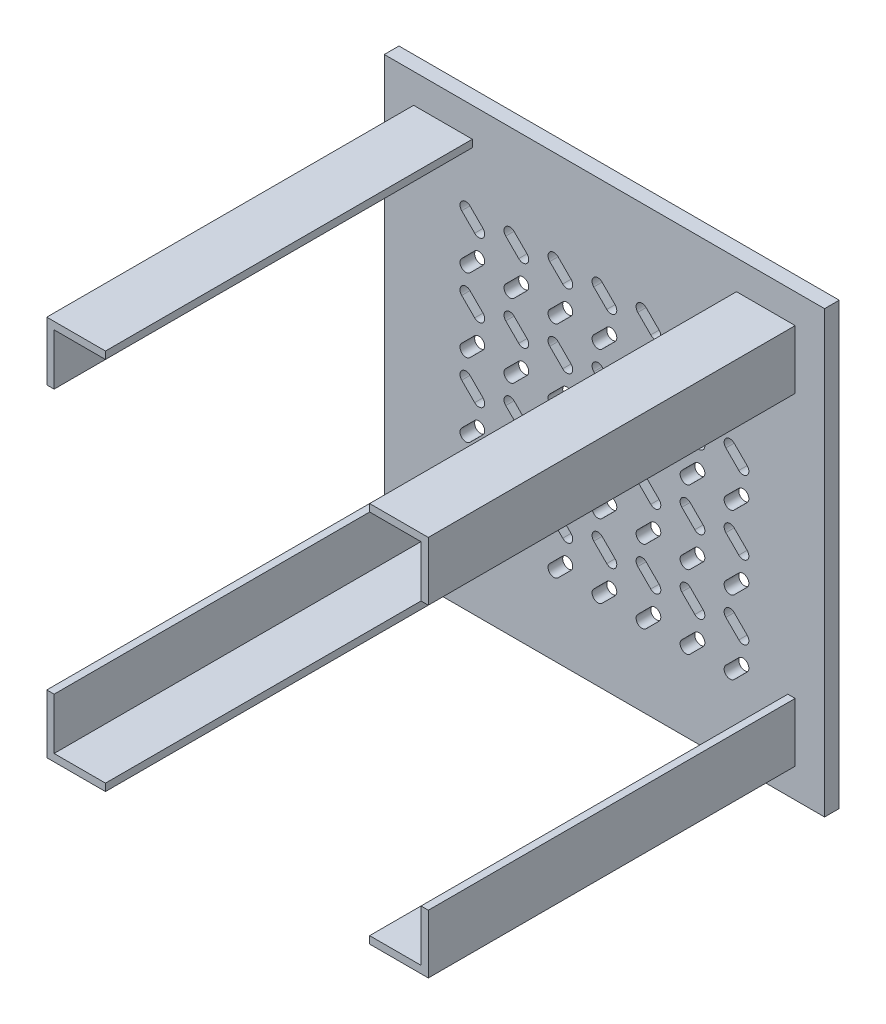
SolidWorks part; units mm, degrees
ref_plane "Front Plane" through (0, 0, 0) normal (0, 0, 1) x (1, 0, 0)
ref_plane "Top Plane" through (0, 0, 0) normal (0, 1, 0) x (1, 0, 0)
ref_plane "Right Plane" through (0, 0, 0) normal (1, 0, 0) x (0, 0, -1)
sketch "Sketch2" plane through (0, 0, 0) normal (0, 1, 0) x (1, 0, 0)
  line L0 (-150, 10) -> (150, 10)
  line L1 (150, 10) -> (150, 0)
  line L4 (150, 0) -> (-150, 0)
  line L7 (-150, 0) -> (-150, 10)
  line L8 (0, 0) -> (0, 128.5458) construction
  point P2 (0, 0)
  point P10 (0, 10)
  dimension "D1" = 300
  dimension "D3" = 10
extrude "Boss-Extrude1" add sketch "Sketch2" along normal mid plane 300 contours L4 L7 L0 L1
sketch "Sketch4" plane through (0, 0, 0) normal (0, 0, 1) x (1, 0, 0)
  line L0 (-130, -90) -> (-130, -130)
  line L1 (130, 90) -> (130, 130)
  line L2 (130, -90) -> (130, -130)
  line L4 (-150, -150) -> (150, -150)
  line L5 (150, -150) -> (150, 150)
  line L6 (150, 150) -> (-150, 150)
  line L7 (150, -150) -> (150, 150)
  line L8 (-150, -150) -> (150, -150)
  line L9 (-150, 150) -> (-150, -150)
  line L10 (150, 150) -> (-150, 150)
  line L11 (-150, 150) -> (-150, -150)
  line L12 (-159.7118, 0) -> (181.5237, 0) construction
  line L13 (-90, -130) -> (-90, -125)
  line L14 (-90, 130) -> (-90, 125)
  line L15 (-125, -90) -> (-130, -90)
  line L16 (-130, -130) -> (130, -130)
  line L17 (130, -130) -> (130, 130)
  line L18 (130, 130) -> (-130, 130)
  line L20 (-130, -130) -> (-90, -130)
  line L21 (-130, 130) -> (-130, -130)
  line L22 (130, 130) -> (90, 130)
  line L23 (-130, 130) -> (-130, 90)
  line L24 (-125, 90) -> (-130, 90)
  line L25 (90, -130) -> (90, -125)
  line L26 (90, 130) -> (90, 125)
  line L27 (125, -90) -> (130, -90)
  line L28 (125, 90) -> (130, 90)
  line L32 (-90, 125) -> (-125, 125)
  line L33 (-125, 125) -> (-125, 90)
  line L34 (-125, -125) -> (-90, -125)
  line L35 (125, -125) -> (125, -90)
  line L36 (125, 125) -> (90, 125)
  line L37 (-125, -90) -> (-125, -125)
  line L42 (-130, -90) -> (-130, -130)
  line L43 (-125, 125) -> (-125, -125) construction
  line L44 (90, -125) -> (125, -125)
  line L45 (-130, 130) -> (-130, -130) construction
  line L46 (90, -130) -> (130, -130)
  line L47 (-125, -125) -> (125, -125) construction
  line L48 (125, 90) -> (125, 125)
  line L49 (-130, -130) -> (130, -130) construction
  line L54 (130, 90) -> (130, 130)
  line L55 (125, -125) -> (125, 125) construction
  line L56 (-90, 130) -> (-130, 130)
  line L57 (130, -130) -> (130, 130) construction
  line L62 (125, 125) -> (-125, 125) construction
  line L64 (130, 130) -> (-130, 130) construction
  point P12 (-75, -80)
  point P14 (-75, 80)
  point P18 (75, -80)
  point P20 (75, 80)
  point P23 (-80, -140)
  point P24 (-80, -85)
  point P25 (-135, -85)
  point P26 (-80, 140)
  point P27 (-80, 85)
  point P28 (-135, 85)
  point P29 (80, -140)
  point P30 (80, -85)
  point P31 (135, -85)
  point P32 (80, 140)
  point P33 (80, 85)
  point P34 (135, 85)
  dimension "D3" = 40
  dimension "D4" = 35
  dimension "D1" = 0
  dimension "D2" = 20
  dimension "D8" = 5
extrude "Boss-Extrude2" add sketch "Sketch4" along normal blind 250 contours L20 L13 L34 L37 L15 L42 | L27 L2 L46 L25 L44 L35 | L48 L36 L26 L22 L54 L28 | L24 L23 L56 L14 L32 L33
sketch "Sketch5" plane through (0, 0, -10) normal (0, 0, -1) x (-1, 0, 0)
  line L0 (94.4194, 87.0051) -> (85.5806, 78.1663) construction
  line L1 (97.2478, 84.1767) -> (88.409, 75.3379)
  line L2 (91.591, 89.8335) -> (82.7522, 80.9947)
  line L3 (85.5806, 62.0051) -> (94.4194, 53.1663) construction
  line L4 (88.409, 64.8335) -> (97.2478, 55.9947)
  line L5 (82.7522, 59.1767) -> (91.591, 50.3379)
  line L6 (0, 150) -> (0, -150) construction
  line L7 (150, 150) -> (-150, 150) construction
  line L8 (150, -150) -> (-150, -150) construction
  line L10 (125, -90) -> (130, -90) construction
  line L11 (90, -90) -> (-90, -90) construction
  line L12 (90, -90) -> (90, 90) construction
  line L13 (90, 90) -> (-90, 90) construction
  line L14 (-90, -90) -> (-90, 90) construction
  line L15 (90, -130) -> (90, -125) construction
  line L16 (-125, 90) -> (-130, 90) construction
  arc A0 (97.2478, 84.1767) -> (91.591, 89.8335) centre (94.4194, 87.0051) ccw
  arc A1 (82.7522, 80.9947) -> (88.409, 75.3379) centre (85.5806, 78.1663) ccw
  arc A2 (88.409, 64.8335) -> (82.7522, 59.1767) centre (85.5806, 62.0051) ccw
  arc A3 (91.591, 50.3379) -> (97.2478, 55.9947) centre (94.4194, 53.1663) ccw
  point P2 (90, 82.5857)
  point P7 (90, 57.5857)
  dimension "D5" = 4
  dimension "D1" = 45
  dimension "D2" = 45
  dimension "D3" = 12.5
  dimension "D4" = 25
extrude "Cut-Extrude1" cut sketch "Sketch5" against normal up to next
pattern_linear "LPattern1" count 4 spacing 50 along (0, -1, 0) of "Cut-Extrude1"
pattern_linear "LPattern2" count 7 spacing 30 along (1, 0, 0) of "LPattern1", "Cut-Extrude1"
